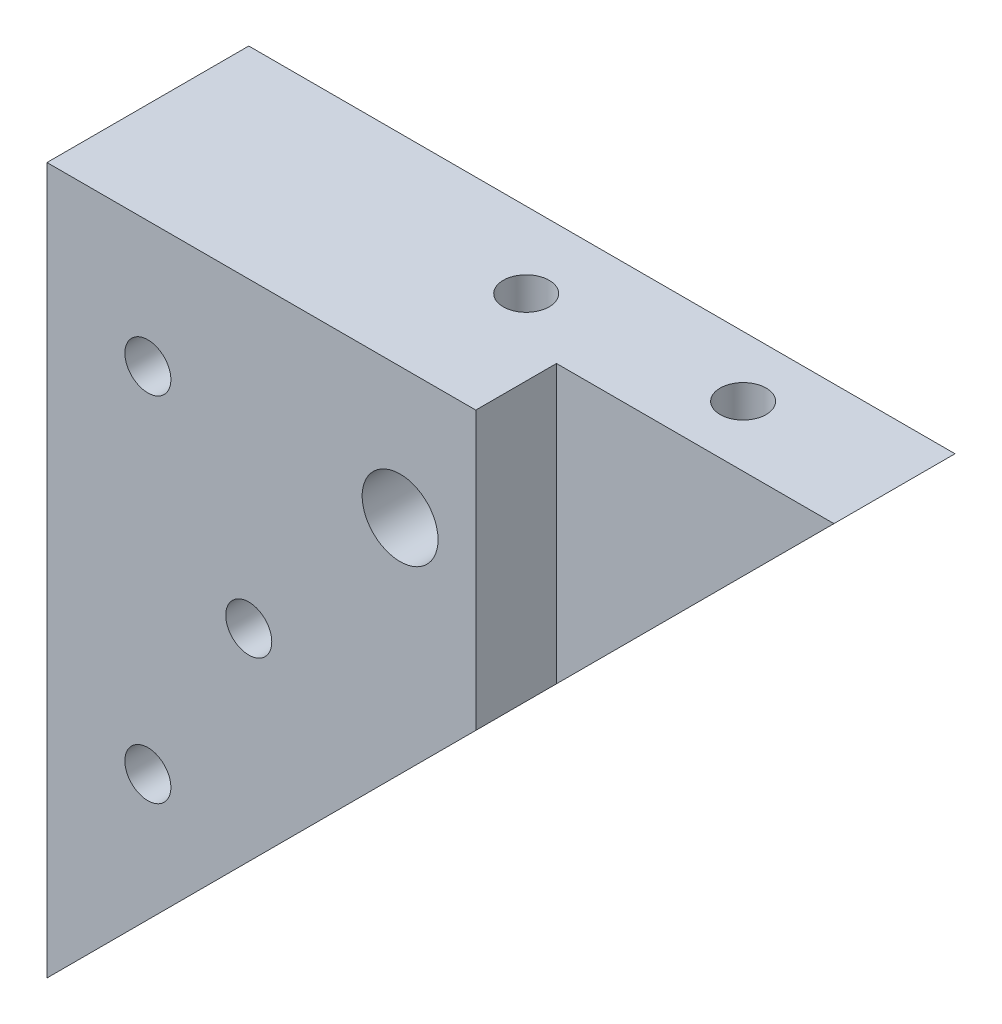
SolidWorks part; units mm, degrees
ref_plane "Front Plane" through (0, 0, 0) normal (0, 0, 1) x (1, 0, 0)
ref_plane "Top Plane" through (0, 0, 0) normal (0, 1, 0) x (1, 0, 0)
ref_plane "Right Plane" through (0, 0, 0) normal (1, 0, 0) x (0, 0, -1)
sketch "Sketch2" plane through (0, 0, 0) normal (0, 0, 1) x (1, 0, 0)
  line L0 (0, 88.9) -> (0, 0)
  line L1 (0, 0) -> (88.9, 88.9)
  line L2 (88.9, 88.9) -> (0, 88.9)
extrude "Extrude1" add sketch "Sketch2" along normal blind 25.4
sketch "Sketch3" plane through (0, 88.9, 0) normal (0, 1, 0) x (-1, 0, 0)
  line L0 (-88.9, 10.16) -> (-53.975, 10.16)
  line L1 (-88.9, 25.4) -> (-88.9, 0) construction
  line L2 (-53.975, 10.16) -> (-53.975, 0)
  line L3 (-88.9, 0) -> (0, 0) construction
  line L4 (-53.975, 0) -> (-88.9, 0)
  line L5 (-88.9, 0) -> (-88.9, 10.16)
extrude "Cut-Extrude1" cut sketch "Sketch3" against normal through all
sketch "Sketch4" plane through (0, 0, 25.4) normal (0, 0, 1) x (1, 0, 0)
  circle A0 centre (44.45, 72.39) radius 4.7752
extrude "Cut-Extrude2" cut sketch "Sketch4" against normal through all
sketch "Sketch5" plane through (0, 88.9, 0) normal (0, 1, 0) x (-1, 0, 0)
  circle A0 centre (-69.85, 17.78) radius 2.8956
extrude "Cut-Extrude3" cut sketch "Sketch5" against normal through all
sketch "Sketch6" plane through (0, 88.9, 0) normal (0, 1, 0) x (-1, 0, 0)
  circle A3 centre (-69.85, 17.78) radius 6.6294
extrude "Cut-Extrude4" cut sketch "Sketch6" against normal blind 19.05 from offset 12.7
sketch "Sketch7" plane through (0, 0, 25.4) normal (0, 0, 1) x (1, 0, 0)
  circle A0 centre (12.7, 73.025) radius 2.8956
  circle A1 centre (12.7, 28.575) radius 2.8956
  circle A2 centre (25.4, 50.8) radius 2.8956
extrude "Cut-Extrude5" cut sketch "Sketch7" against normal through all
chamfer "Chamfer1" distance 2.032 angle 41 3 edges at (15.5956, 28.575, 25.4) (15.5956, 73.025, 25.4) (28.2956, 50.8, 25.4)
sketch "Sketch9" plane through (0, 88.9, 0) normal (0, 1, 0) x (-1, 0, 0)
  circle A0 centre (-44.45, 15.875) radius 2.8956
extrude "Cut-Extrude7" cut sketch "Sketch9" against normal blind 25.4
mirror "Mirror1" about plane through (0, 88.9, 0) normal (0, 0, 1)
delete or keep bodies "Body-Delete1" type delete bodies bodies 108
